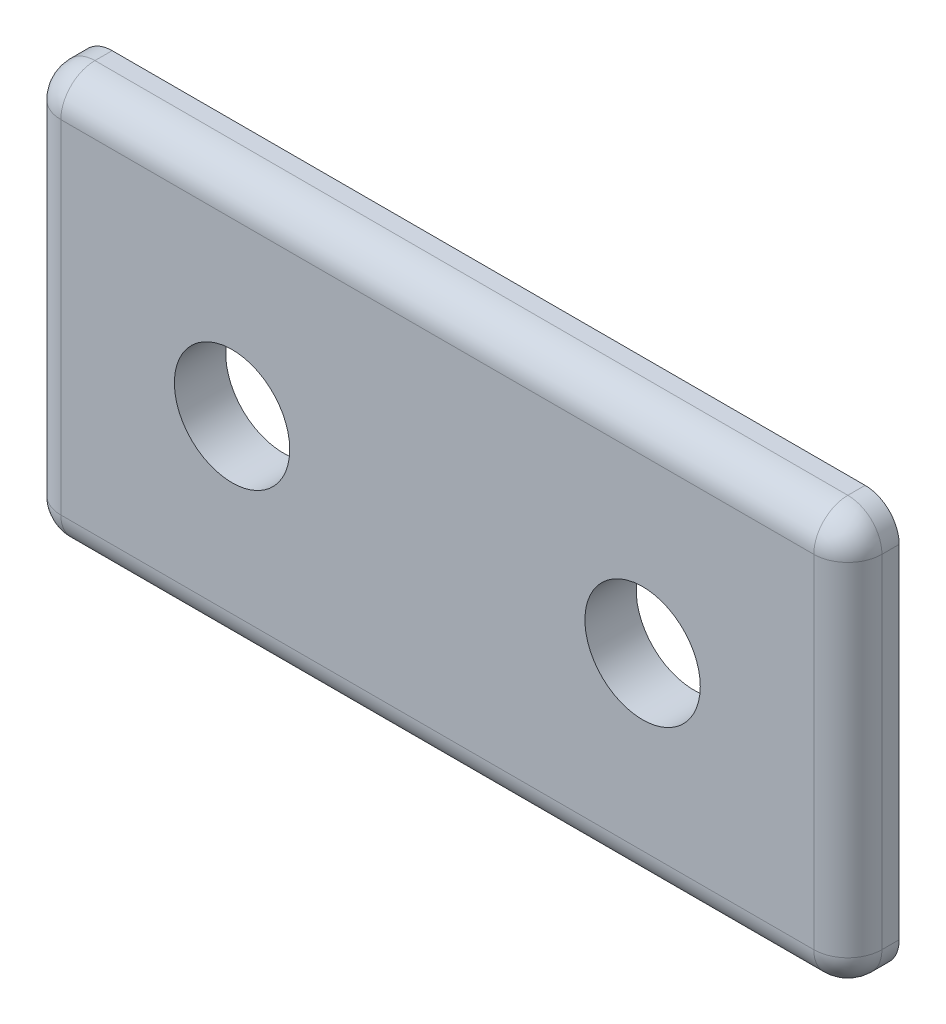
SolidWorks part; units mm, degrees
ref_plane "Front Plane" through (0, 0, 0) normal (0, 0, 1) x (1, 0, 0)
ref_plane "Top Plane" through (0, 0, 0) normal (0, 1, 0) x (1, 0, 0)
ref_plane "Right Plane" through (0, 0, 0) normal (1, 0, 0) x (0, 0, -1)
sketch "Sketch1" plane through (0, 0, 0) normal (0, 0, 1) x (1, 0, 0)
  line L0 (-25.4, 0) -> (25.4, 0) construction
  line L1 (-25.4, 12.7) -> (25.4, 12.7)
  line L2 (-25.4, 12.7) -> (-25.4, -12.7)
  line L3 (-25.4, -12.7) -> (25.4, -12.7)
  line L4 (25.4, 12.7) -> (25.4, -12.7)
  line L5 (0, 12.7) -> (0, -12.7) construction
  dimension "D1" = 25.4
  dimension "D2" = 50.8
extrude "Boss-Extrude1" add sketch "Sketch1" along normal blind 3.175
fillet "Fillet1" radius 2.1082 8 edges at (0, 12.7, 3.175) (25.4, 0, 3.175) (0, -12.7, 3.175) (-25.4, 0, 3.175) (-25.4, -12.7, 1.5875) (25.4, -12.7, 1.5875) (25.4, 12.7, 1.5875) (-25.4, 12.7, 1.5875)
sketch "Sketch2" plane through (0, 0, 3.175) normal (0, 0, 1) x (1, 0, 0)
  line L1 (-12.7, 0) -> (12.7, 0) construction
  circle A0 centre (-12.7, 0) radius 3.5687
  circle A1 centre (12.7, 0) radius 3.5687
  dimension "D2" = 7.1374
  dimension "D1" = 25.4
extrude "Cut-Extrude1" cut sketch "Sketch2" against normal up to next
